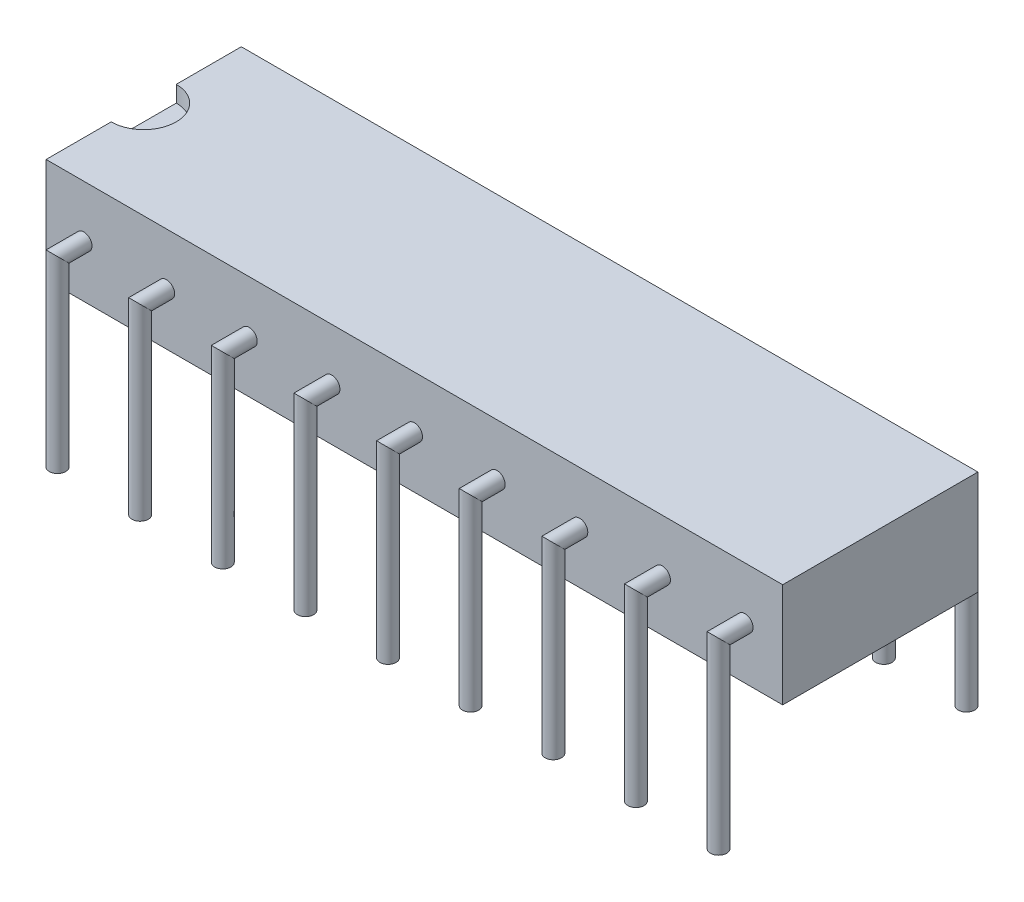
SolidWorks part; units mm, degrees
ref_plane "Plan de face" through (0, 0, 0) normal (0, 0, 1) x (1, 0, 0)
ref_plane "Plan de dessus" through (0, 0, 0) normal (0, 1, 0) x (1, 0, 0)
ref_plane "Plan de droite" through (0, 0, 0) normal (1, 0, 0) x (0, 0, -1)
sketch "Esquisse1" plane through (0, 0, 0) normal (1, 0, 0) x (0, 0, -1)
  line L0 (-34.0084, 0) -> (28.7946, 0) construction
  line L1 (0, -15.76) -> (0, 25.9507) construction
  line L2 (-13.1897, 3.2) -> (13.1184, 3.2) construction
  line L3 (3, 10.112) -> (3, -6.1718) construction
  line L4 (-3, 10.112) -> (-3, -4.99) construction
  line L6 (-3, 3.2) -> (3, 3.2)
  line L7 (-3, 3.2) -> (-3, 0)
  line L8 (-3, 0) -> (3, 0)
  line L9 (3, 3.2) -> (3, 0)
  dimension "D1" = 3
  dimension "D2" = 6
  dimension "D3" = 3.2
extrude "Extrusion1" add sketch "Esquisse1" along normal blind 22.64
sketch "Esquisse2" plane through (0, 3.2, 0) normal (0, 1, 0) x (-1, 0, 0)
  line L0 (0, -1) -> (0, 1)
  arc A0 (0, 1) -> (0, -1) centre (0, 0) ccw
extrude "Enlèv. mat.-Extru.1" cut sketch "Esquisse2" against normal blind 0.5
sketch "Esquisse3" plane through (0, 0, 3) normal (0, 0, 1) x (1, 0, 0)
  line L0 (-0.9705, 0) -> (10.7632, 0) construction
  line L1 (0, 4.319) -> (0, -1.0907) construction
  line L2 (-0.7349, 1.6) -> (2.3847, 1.6) construction
  line L3 (1.16, 2.698) -> (1.16, -1.0907) construction
  circle A0 centre (1.16, 1.6) radius 0.25
  dimension "D1" = 1.6
  dimension "D2" = 1.16
ref_plane "Plan1" through (1.16, 0, 0) normal (1, 0, 0) x (0, 0, -1)
sketch "Esquisse5" plane through (1.16, 0, 0) normal (1, 0, 0) x (0, 0, -1)
  line L0 (-4.2866, 0) -> (4.976, 0) construction
  line L1 (-3, -1.7147) -> (-3, 5.2592) construction
  line L2 (-4.2866, -4) -> (4.976, -4) construction
  line L3 (-3.81, -4.4343) -> (-3.81, 4.8284) construction
  line L4 (-4.9369, 1.6) -> (-3, 1.6) construction
  line L5 (-3, 1.6) -> (-3.81, 1.6)
  line L6 (-3.81, 1.6) -> (-3.81, -4)
  dimension "D1" = 4
  dimension "D2" = 0.81
sweep "Balayage1" add profiles "Esquisse3" path "Esquisse5"
ref_plane "Plan2" through (0, 0, 0) normal (0, 0, 1) x (1, 0, 0)
mirror "Symétrie1" about plane through (0, 0, 0) normal (0, 0, 1) of "Balayage1"
pattern_linear "Répétition linéaire1" count 9 spacing 2.54 along (1, 0, 0) of "Balayage1", "Symétrie1"
